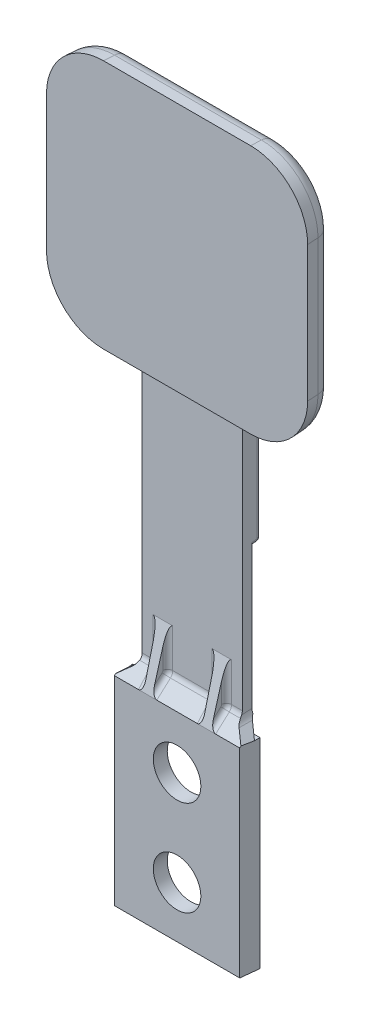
SolidWorks part; units mm, degrees
ref_plane "Front Plane" through (0, 0, 0) normal (0, 0, 1) x (1, 0, 0)
ref_plane "Top Plane" through (0, 0, 0) normal (0, 1, 0) x (1, 0, 0)
ref_plane "Right Plane" through (0, 0, 0) normal (1, 0, 0) x (0, 0, -1)
sketch "Sketch1" plane through (0, 0, 0) normal (0, 0, 1) x (1, 0, 0)
  line L1 (-7.366, -12.5095) -> (7.366, -12.5095)
  line L2 (-13.081, -6.7945) -> (-13.081, 6.7945)
  line L3 (-7.366, 12.5095) -> (7.366, 12.5095)
  line L4 (13.081, -6.7945) -> (13.081, 6.7945)
  line L5 (-13.081, -12.5095) -> (13.081, 12.5095) construction
  line L6 (-13.081, 12.5095) -> (13.081, -12.5095) construction
  circle A0 centre (0, 0) radius 12.5095 construction
  arc A1 (-13.081, -6.7945) -> (-7.366, -12.5095) centre (-7.366, -6.7945) ccw
  arc A2 (7.366, -12.5095) -> (13.081, -6.7945) centre (7.366, -6.7945) ccw
  arc A3 (13.081, 6.7945) -> (7.366, 12.5095) centre (7.366, 6.7945) ccw
  arc A4 (-7.366, 12.5095) -> (-13.081, 6.7945) centre (-7.366, 6.7945) ccw
  dimension "D1" = 25.019
  dimension "D4" = 5.715
  dimension "D2" = 25.019
  dimension "D3" = 26.162
extrude "Extrude1" add sketch "Sketch1" against normal blind 2.54 draft 3
fillet "Fillet1" radius 1.524 8 edges at (11.313, 10.7415, -2.54) (12.9479, 0, -2.54) (11.313, -10.7415, -2.54) (0, -12.3764, -2.54) (-11.313, -10.7415, -2.54) (-12.9479, 0, -2.54) (-11.313, 10.7415, -2.54) (0, 12.3764, -2.54)
sketch "Sketch2" plane through (0, 0, 0) normal (1, 0, 0) x (0, 0, -1)
  line L0 (2.54, -8.3902) -> (2.54, -39.1922)
  line L1 (2.54, -39.1922) -> (1.397, -40.3352)
  line L2 (1.397, -40.3352) -> (1.397, -60.325)
  line L3 (2.54, -10.9302) -> (1.524, -10.9302) construction
  line L4 (1.524, -8.3902) -> (1.524, -38.7714)
  line L5 (0, -40.2954) -> (0, -60.325)
  line L6 (0, -60.325) -> (1.397, -60.325)
  line L7 (1.524, -38.7714) -> (0, -40.2954)
  line L8 (2.54, -8.3902) -> (1.524, -8.3902)
  line L11 (2.54, -10.9302) -> (1.524, -10.9302) construction
  dimension "D1" = 39.1922
  dimension "D2" = 1.016
  dimension "D3" = 1.397
  dimension "D4" = 1.143
  dimension "D5" = 60.325
  dimension "D6" = 1.016
  dimension "D7" = 135
  dimension "D8" = 2.54
extrude "Boss-Extrude1" add sketch "Sketch2" along normal mid plane 10.033
sketch "Sketch3" plane through (5.0165, 0, 0) normal (1, 0, 0) x (0, 0, -1)
  line L0 (1.397, -60.325) -> (1.397, -40.3352) construction
  line L1 (0, -60.325) -> (1.397, -60.325) construction
  line L2 (0, -40.2954) -> (0, -60.325) construction
  line L3 (1.397, -60.325) -> (1.397, -40.3352)
  line L4 (0, -60.325) -> (1.397, -60.325)
  line L5 (0, -40.2954) -> (0, -60.325)
  line L6 (1.397, -40.3352) -> (2.54, -39.1922) construction
  line L7 (1.524, -38.7714) -> (0, -40.2954) construction
  line L8 (1.397, -40.3352) -> (2.54, -39.1922)
  line L9 (1.1032, -39.1922) -> (0, -40.2954)
  line L10 (2.54, -39.1922) -> (1.1032, -39.1922)
extrude "Boss-Extrude2" add sketch "Sketch3" along normal offset from surface (1.3335 mm away) 6.35
sketch "Sketch4" plane through (0, 0, -1.397) normal (0, 0, -1) x (-1, 0, 0)
  line L0 (-6.35, -40.3352) -> (-7.2577, -40.3352)
  line L1 (-7.2577, -40.3352) -> (-7.2577, -39.1922)
  line L2 (-7.2577, -39.1922) -> (-5.0165, -39.1922)
  line L3 (-5.0165, -39.1922) -> (-5.0165, -10.9302) construction
  line L4 (-6.35, -39.1922) -> (-5.0165, -39.1922) construction
  line L5 (-5.0165, -39.1922) -> (-6.35, -40.3352)
extrude "Cut-Extrude1" cut sketch "Sketch4" against normal through all and the other way through all
sketch "Sketch5" plane through (-5.0165, 0, 0) normal (-1, 0, 0) x (0, 0, 1)
  line L5 (-2.54, -39.1922) -> (-1.1032, -39.1922)
  line L6 (-1.397, -60.325) -> (-1.397, -40.3352) construction
  line L7 (0, -40.2954) -> (0, -60.325) construction
  line L8 (-1.524, -38.7714) -> (0, -40.2954) construction
  line L9 (-1.397, -40.3352) -> (-2.54, -39.1922) construction
  line L10 (-1.397, -60.325) -> (-1.397, -40.3352)
  line L11 (0, -40.2954) -> (0, -60.325)
  line L12 (-1.1032, -39.1922) -> (0, -40.2954)
  line L13 (-1.397, -40.3352) -> (-2.54, -39.1922)
  line L14 (0, -60.325) -> (-1.397, -60.325) construction
  line L15 (0, -60.325) -> (-1.397, -60.325)
extrude "Boss-Extrude4" add sketch "Sketch5" along normal offset from surface (1.3335 mm away) 6.35
sketch "Sketch6" plane through (0, 0, -1.397) normal (0, 0, -1) x (-1, 0, 0)
  line L0 (6.35, -40.3352) -> (7.9021, -40.3352)
  line L1 (7.9021, -40.3352) -> (7.9021, -39.1922)
  line L2 (5.0165, -39.1922) -> (7.9021, -39.1922)
  line L3 (6.35, -40.3352) -> (5.0165, -39.1922)
extrude "Cut-Extrude2" cut sketch "Sketch6" against normal through all and the other way through all
fillet "Fillet2" radius 0.889 2 edges at (5.0165, -39.1922, -1.8216) (-5.0165, -39.1922, -1.8216)
fillet "Fillet3" radius 1.016 1 edges at (0, -12.367, -1.524)
draft "Draft1" type of draft neutral plane draft angle 3 faces to draft 6 parameters "D1"=3
draft "Draft2" type of draft neutral plane draft angle 3 faces to draft 3 parameters "D1"=3
sketch "Sketch7" plane through (0, 0, -2.54) normal (0, 0, -1) x (-1, 0, 0)
  line L0 (-4.9633, -38.7833) -> (-4.9633, -10.9302) construction
  line L1 (4.9633, -38.7833) -> (4.9633, -10.9302) construction
  line L2 (-4.9633, -24.765) -> (-4.9633, -7.4214)
  line L3 (4.9633, -24.765) -> (4.9633, -7.4214)
  arc A0 (4.9633, -7.4214) -> (-4.9633, -7.4214) centre (0, 0) ccw
  dimension "D1" = 17.8562
  dimension "D2" = 24.765
extrude "Extrude-Thin2" add sketch "Sketch7" along normal blind 0.9271 draft 3 thin
fillet "Fillet4" radius 0.381 4 edges at (-4.939, -24.7407, -3.0035) (-4.0985, -24.7407, -3.0035) (4.0985, -24.7407, -3.0035) (4.939, -24.7407, -3.0035)
fillet "Fillet5" radius 0.4064 12 edges at (-4.2342, -24.605, -3.4671) (-4.1228, -15.6469, -3.4671) (0, 8.0877, -3.4671) (4.1228, -15.6469, -3.4671) (4.2342, -24.605, -3.4671) (4.5188, -24.7164, -3.4671) (4.8033, -24.605, -3.4671) (4.9147, -15.8657, -3.4671) (0, 8.8795, -3.4671) (-4.9147, -15.8657, -3.4671) (-4.8033, -24.605, -3.4671) (-4.5188, -24.7164, -3.4671)
fillet "Fillet6" radius 0.4445 4 edges at (-4.1864, -6.9941, -3.3086) (4.1864, -6.9941, -3.3086)
sketch "Sketch8" plane through (0, 0, -1.397) normal (0, 0, -1) x (-1, 0, 0)
  line L0 (-6.35, -60.325) -> (-6.35, -40.3352) construction
  line L1 (-6.35, -60.325) -> (-6.35, -40.3352)
extrude "Extrude-Thin3" add sketch "Sketch8" along normal blind 0.5334 draft 3 thin
mirror "Mirror5" about plane through (0, 0, 0) normal (1, 0, 0) of "Extrude-Thin3"
draft "Draft4" type of draft neutral plane draft angle 3 faces to draft 2 parameters "D1"=3
sketch "Sketch9" plane through (0, 0, 0) normal (1, 0, 0) x (0, 0, -1)
  line L0 (2.54, -6.804) -> (2.54, 8.0391) construction
  line L1 (2.54, -10.2108) -> (2.54, 3.175)
  line L2 (2.54, -10.2108) -> (4.7498, 2.7997)
  line L3 (4.7498, 2.7997) -> (2.54, 3.175)
  dimension "D1" = 2.2098
  dimension "D2" = 3.175
  dimension "D3" = 13.3858
extrude "Boss-Extrude5" add sketch "Sketch9" along normal mid plane 3.9624
fillet "Fillet7" radius 1.9812 2 edges at (-1.9812, 2.9873, -3.6449) (1.9812, 2.9873, -3.6449)
ref_plane "Plane3" through (2.4384, 0, 0) normal (1, 0, 0) x (0, 0, -1)
sketch "Sketch11" plane through (2.4384, 0, 0) normal (1, 0, 0) x (0, 0, -1)
  line L0 (0.115, -40.1804) -> (0.8633, -39.432) construction
  line L1 (0, -40.2954) -> (1.524, -38.7714)
  line L2 (1.524, -13.5003) -> (1.524, -38.7714) construction
  line L3 (1.524, -34.5804) -> (1.524, -38.7714)
  line L4 (0, -40.2954) -> (1.524, -34.5804)
  dimension "D1" = 5.715
extrude "Boss-Extrude6" add sketch "Sketch11" along normal blind 1.016
draft "Draft3" type of draft neutral plane draft angle 3 faces to draft 2 parameters "D1"=3
mirror "Mirror6" about plane through (0, 0, 0) normal (1, 0, 0) of "Draft3", "Boss-Extrude6"
fillet "Fillet8" radius 0.762 3 edges at (4.2355, -38.7714, -1.524) (0, -38.7714, -1.524) (-4.2355, -38.7714, -1.524)
fillet "Fillet9" radius 0.508 12 edges at (3.4086, -39.645, -0.6504) (3.4514, -38.7473, -1.466) (-2.4842, -39.645, -0.6504) (-2.4414, -38.7473, -1.466) (2.4842, -39.645, -0.6504) (2.4414, -38.7473, -1.466) (-3.4086, -39.645, -0.6504) (-3.4514, -38.7473, -1.466) (3.4544, -36.518, -1.524) (-2.4384, -36.518, -1.524) (2.4384, -36.518, -1.524) (-3.4544, -36.518, -1.524)
sketch "Sketch12" plane through (0, 0, -1.397) normal (0, 0, -1) x (-1, 0, 0)
  line L0 (0, 0) -> (0, -64.0136) construction
  line L1 (-5.715, -60.325) -> (5.715, -60.325) construction
  circle A0 centre (0, -45.5739) radius 2.3812
  circle A1 centre (0, -55.0989) radius 2.3812
  dimension "D1" = 9.525
  dimension "D2" = 4.7625
  dimension "D3" = 5.226
extrude "Cut-Extrude3" cut sketch "Sketch12" against normal through all
equation "\".3950.100in\"=0.1"
